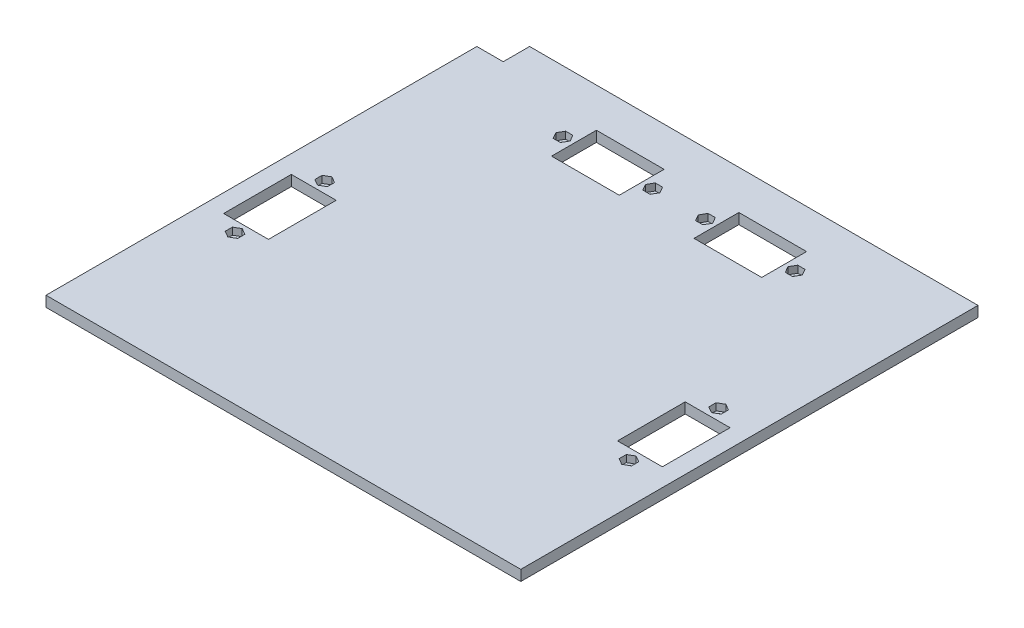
SolidWorks part; units mm, degrees
ref_plane "Front Plane" through (0, 0, 0) normal (0, 0, 1) x (1, 0, 0)
ref_plane "Top Plane" through (0, 0, 0) normal (0, 1, 0) x (1, 0, 0)
ref_plane "Right Plane" through (0, 0, 0) normal (1, 0, 0) x (0, 0, -1)
sketch "Sketch1" plane through (0, 0, 0) normal (0, 1, 0) x (1, 0, 0)
  line L1 (-135, -130) -> (135, -130)
  line L2 (-135, -130) -> (-135, 130)
  line L3 (-135, 130) -> (135, 130)
  line L4 (135, -130) -> (135, 130)
  line L5 (-135, -130) -> (135, 130) construction
  line L6 (-135, 130) -> (135, -130) construction
  point P0 (0, 0)
  dimension "D1" = 270
  dimension "D2" = 260
extrude "Boss-Extrude1" add sketch "Sketch1" along normal blind 6
sketch "Sketch2" plane through (0, 6, 0) normal (0, 1, 0) x (1, 0, 0)
  line L0 (-112, -45.5) -> (-112, 5.5) construction
  line L1 (-124.75, -39.25) -> (-99.25, -39.25)
  line L2 (-124.75, -39.25) -> (-124.75, -0.75)
  line L3 (-124.75, -0.75) -> (-99.25, -0.75)
  line L4 (-99.25, -39.25) -> (-99.25, -0.75)
  line L5 (-124.75, -39.25) -> (-99.25, -0.75) construction
  line L6 (-124.75, -0.75) -> (-99.25, -39.25) construction
  line L7 (-59.75, 107.75) -> (-21.25, 107.75)
  line L8 (-59.75, 107.75) -> (-59.75, 82.25)
  line L9 (-59.75, 82.25) -> (-21.25, 82.25)
  line L10 (-21.25, 107.75) -> (-21.25, 82.25)
  line L11 (-59.75, 107.75) -> (-21.25, 82.25) construction
  line L12 (-59.75, 82.25) -> (-21.25, 107.75) construction
  line L13 (-15, 95) -> (-66, 95) construction
  line L14 (135, 130) -> (-135, 130) construction
  line L15 (-135, 130) -> (-135, -130) construction
  line L16 (0, 0) -> (0, 130) construction
  line L17 (124.75, -0.75) -> (99.25, -0.75)
  line L18 (99.25, -39.25) -> (99.25, -0.75)
  line L19 (124.75, -39.25) -> (99.25, -39.25)
  line L20 (124.75, -39.25) -> (124.75, -0.75)
  line L21 (59.75, 82.25) -> (21.25, 82.25)
  line L22 (21.25, 107.75) -> (21.25, 82.25)
  line L23 (59.75, 107.75) -> (21.25, 107.75)
  line L24 (59.75, 107.75) -> (59.75, 82.25)
  circle A0 centre (-112, 5.5) radius 2
  circle A1 centre (-112, -45.5) radius 2
  circle A2 centre (-66, 95) radius 2
  circle A3 centre (-15, 95) radius 2
  circle A4 centre (112, -45.5) radius 2
  circle A5 centre (112, 5.5) radius 2
  circle A6 centre (66, 95) radius 2
  circle A7 centre (15, 95) radius 2
  point P0 (-112, -20)
  point P5 (-40.5, 95)
  point P14 (-112, -20)
  point P18 (-40.5, 95)
  dimension "D3" = 4
  dimension "D6" = 23
  dimension "D1" = 38.5
  dimension "D2" = 25.5
  dimension "D4" = 51
  dimension "D5" = 150
  dimension "D7" = 35
  dimension "D8" = 94.5
extrude "Cut-Extrude1" cut sketch "Sketch2" against normal blind 10
sketch "Sketch3" plane through (0, 6, 0) normal (0, 1, 0) x (1, 0, 0)
  line L1 (-68.0496, 98.55) -> (-70.0992, 95)
  line L2 (-70.0992, 95) -> (-68.0496, 91.45)
  line L3 (-68.0496, 91.45) -> (-63.9504, 91.45)
  line L4 (-63.9504, 91.45) -> (-61.9008, 95)
  line L5 (-61.9008, 95) -> (-63.9504, 98.55)
  line L6 (-63.9504, 98.55) -> (-68.0496, 98.55)
  line L7 (-12.9504, 98.55) -> (-17.0496, 98.55)
  line L8 (-17.0496, 98.55) -> (-19.0992, 95)
  line L9 (-19.0992, 95) -> (-17.0496, 91.45)
  line L10 (-17.0496, 91.45) -> (-12.9504, 91.45)
  line L11 (-12.9504, 91.45) -> (-10.9008, 95)
  line L12 (-10.9008, 95) -> (-12.9504, 98.55)
  line L13 (12.9504, 98.55) -> (10.9008, 95)
  line L14 (10.9008, 95) -> (12.9504, 91.45)
  line L15 (12.9504, 91.45) -> (17.0496, 91.45)
  line L16 (17.0496, 91.45) -> (19.0992, 95)
  line L17 (19.0992, 95) -> (17.0496, 98.55)
  line L18 (17.0496, 98.55) -> (12.9504, 98.55)
  line L19 (63.9504, 98.55) -> (61.9008, 95)
  line L20 (61.9008, 95) -> (63.9504, 91.45)
  line L21 (63.9504, 91.45) -> (68.0496, 91.45)
  line L22 (68.0496, 91.45) -> (70.0992, 95)
  line L23 (70.0992, 95) -> (68.0496, 98.55)
  line L24 (68.0496, 98.55) -> (63.9504, 98.55)
  line L25 (115.55, 7.5496) -> (112, 9.5992)
  line L26 (112, 9.5992) -> (108.45, 7.5496)
  line L27 (108.45, 7.5496) -> (108.45, 3.4504)
  line L28 (108.45, 3.4504) -> (112, 1.4008)
  line L29 (112, 1.4008) -> (115.55, 3.4504)
  line L30 (115.55, 3.4504) -> (115.55, 7.5496)
  line L31 (115.55, -47.5496) -> (115.55, -43.4504)
  line L32 (115.55, -43.4504) -> (112, -41.4008)
  line L33 (112, -41.4008) -> (108.45, -43.4504)
  line L34 (108.45, -43.4504) -> (108.45, -47.5496)
  line L35 (108.45, -47.5496) -> (112, -49.5992)
  line L36 (112, -49.5992) -> (115.55, -47.5496)
  line L37 (-108.45, 7.5496) -> (-112, 9.5992)
  line L38 (-112, 9.5992) -> (-115.55, 7.5496)
  line L39 (-115.55, 7.5496) -> (-115.55, 3.4504)
  line L40 (-115.55, 3.4504) -> (-112, 1.4008)
  line L41 (-112, 1.4008) -> (-108.45, 3.4504)
  line L42 (-108.45, 3.4504) -> (-108.45, 7.5496)
  line L43 (-108.45, -43.4504) -> (-112, -41.4008)
  line L44 (-112, -41.4008) -> (-115.55, -43.4504)
  line L45 (-115.55, -43.4504) -> (-115.55, -47.5496)
  line L46 (-115.55, -47.5496) -> (-112, -49.5992)
  line L47 (-112, -49.5992) -> (-108.45, -47.5496)
  line L48 (-108.45, -47.5496) -> (-108.45, -43.4504)
  circle A0 centre (-66, 95) radius 3.55 construction
  circle A1 centre (-15, 95) radius 3.55 construction
  circle A2 centre (15, 95) radius 3.55 construction
  circle A3 centre (66, 95) radius 3.55 construction
  circle A4 centre (112, 5.5) radius 3.55 construction
  circle A5 centre (112, -45.5) radius 3.55 construction
  circle A6 centre (-112, 5.5) radius 3.55 construction
  circle A7 centre (-112, -45.5) radius 3.55 construction
  dimension "D1" = 7.1
extrude "Cut-Extrude2" cut sketch "Sketch3" against normal blind 4
sketch "Sketch4" plane through (0, 6, 0) normal (0, 1, 0) x (1, 0, 0)
  line L1 (-135, 130) -> (-120, 130)
  line L2 (-135, 130) -> (-135, 115)
  line L3 (-135, 115) -> (-120, 115)
  line L4 (-120, 130) -> (-120, 115)
  dimension "D1" = 15
  dimension "D2" = 15
extrude "Cut-Extrude3" cut sketch "Sketch4" against normal through all
